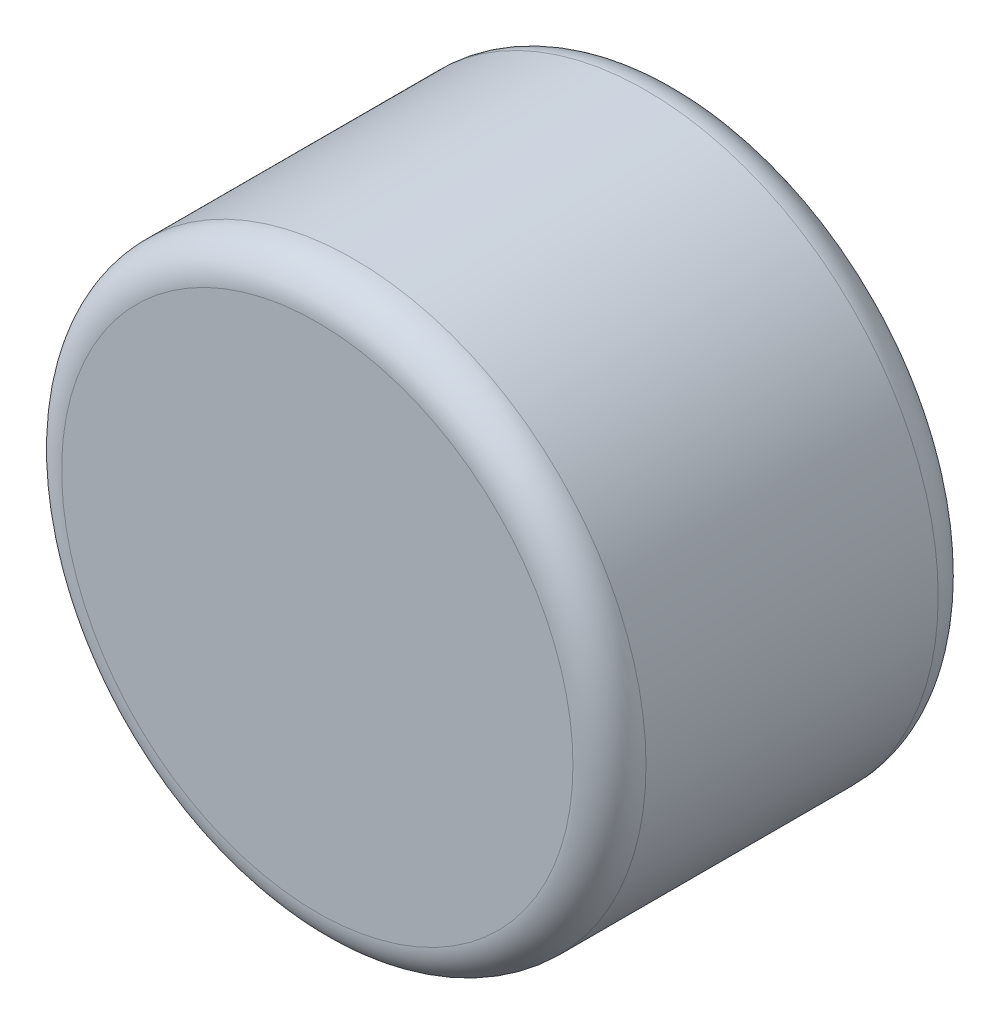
SolidWorks part; units mm, degrees
ref_plane "Plan de face" through (0, 0, 0) normal (0, 0, 1) x (1, 0, 0)
ref_plane "Plan de dessus" through (0, 0, 0) normal (0, 1, 0) x (1, 0, 0)
ref_plane "Plan de droite" through (0, 0, 0) normal (1, 0, 0) x (0, 0, -1)
sketch "Esquisse1" plane through (0, 0, 0) normal (0, 0, 1) x (1, 0, 0)
  circle A0 centre (0, 0) radius 4
extrude "Boss.-Extru.1" add sketch "Esquisse1" along normal blind 5
fillet "Congé1" radius 0.5 2 edges at (4, 0, 0) (4, 0, 5)
